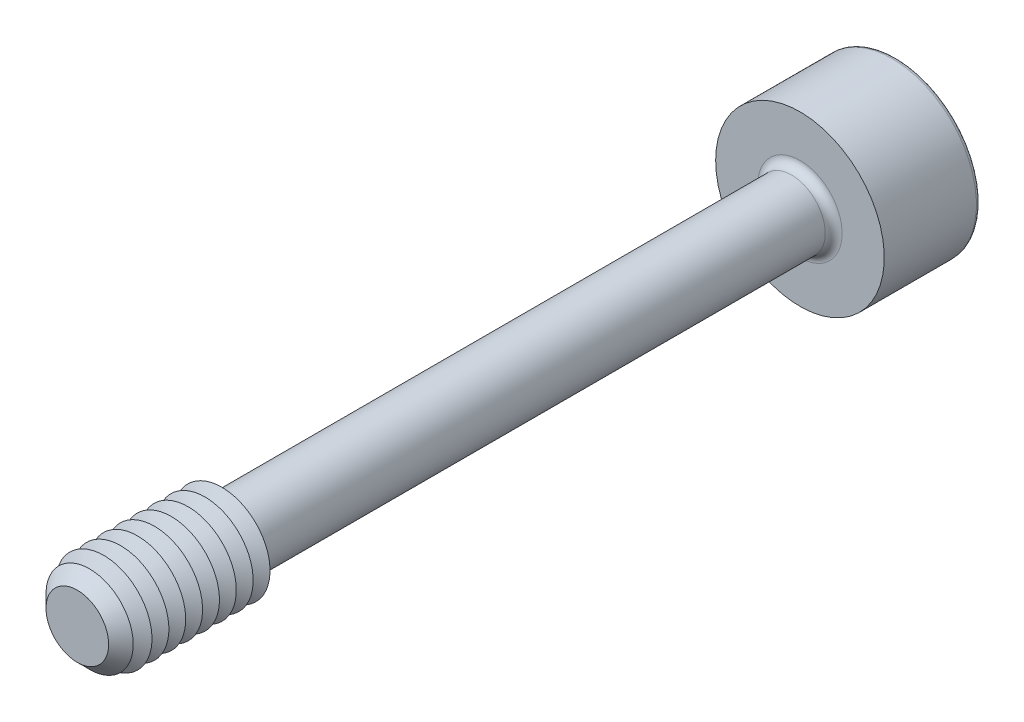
SolidWorks part; units mm, degrees
ref_plane "Front Plane" through (0, 0, 0) normal (0, 0, 1) x (1, 0, 0)
ref_plane "Top Plane" through (0, 0, 0) normal (0, 1, 0) x (1, 0, 0)
ref_plane "Right Plane" through (0, 0, 0) normal (1, 0, 0) x (0, 0, -1)
sketch "Sketch1" plane through (0, 0, 0) normal (0, 0, 1) x (1, 0, 0)
  circle A0 centre (0, 0) radius 1.4
  dimension "D1" = 2.8
extrude "Extrude1" add sketch "Sketch1" along normal mid plane 30
sketch "Sketch2" plane through (0, 0, 0) normal (1, 0, 0) x (0, 0, -1)
  line L0 (-15, 0) -> (-15, 2)
  line L1 (-15, 1.4) -> (-15, -1.4) construction
  line L2 (-15, 2) -> (-9, 2)
  line L3 (-9, 2) -> (-8.6536, 1.4)
  line L4 (15, 1.4) -> (-15, 1.4) construction
  line L5 (-8.6536, 1.4) -> (-8.6536, 0)
  line L6 (-8.6536, 0) -> (-15, 0)
  dimension "D1" = 2
  dimension "D2" = 120
  dimension "D3" = 6
revolve "Revolve1" add sketch "Sketch2" angle 360 about L6
chamfer "Chamfer1" distance 0.7 angle 45 1 edges at (0, 2, 15)
sketch "Sketch3" plane through (0, 0, -15) normal (0, 0, -1) x (-1, 0, 0)
  circle A0 centre (0, 0) radius 3.5
  dimension "D1" = 7
extrude "Extrude2" add sketch "Sketch3" along normal blind 4
sketch "Sketch4" plane through (-13.7, 0, -19) normal (0, 0, 1) x (1, 0, 0)
  line L2 (12.834, -1.5) -> (14.566, -1.5)
  line L3 (14.566, -1.5) -> (15.4321, 0)
  line L4 (15.4321, 0) -> (14.566, 1.5)
  line L6 (14.566, 1.5) -> (12.834, 1.5)
  line L7 (12.834, 1.5) -> (11.9679, 0)
  line L8 (11.9679, 0) -> (12.834, -1.5)
  circle A0 centre (13.7, 0) radius 1.5 construction
  dimension "D1" = 3
extrude "Extrude3" cut sketch "Sketch4" along normal blind 3
fillet "Fillet1" radius 0.35 1 edges at (-1.4, 0, -15)
fillet "Fillet2" radius 0.175 1 edges at (-3.5, 0, -19)
sketch "Sketch5" plane through (0, 0, 0) normal (1, 0, 0) x (0, 0, -1)
  line L0 (16, 0) -> (16, -1.5)
  line L1 (16, -1.5) -> (15.134, 0)
  line L2 (15.134, 0) -> (16, 0)
  dimension "D1" = 30
revolve "Cut-Revolve1" cut sketch "Sketch5" angle 360 about L2
sketch "Sketch6" plane through (0, 0, 0) normal (1, 0, 0) x (0, 0, -1)
  line L0 (1.332, 0) -> (-13.289, 0) construction
sketch "Sketch7" plane through (0, 0, 0) normal (1, 0, 0) x (0, 0, -1)
  line L0 (-9, 2) -> (-9.35, 1.3938)
  line L1 (-9.35, 1.3938) -> (-9.7, 2)
  line L2 (-9, 2) -> (-14.3, 2) construction
  line L3 (-9.7, 2) -> (-9, 2)
  dimension "D1" = 0.7
revolve "Cut-Revolve2" cut sketch "Sketch7" angle 360 about L0
pattern_linear "LPattern1" count 8 spacing 0.7 along (0, 0, 1) of "Cut-Revolve2"
